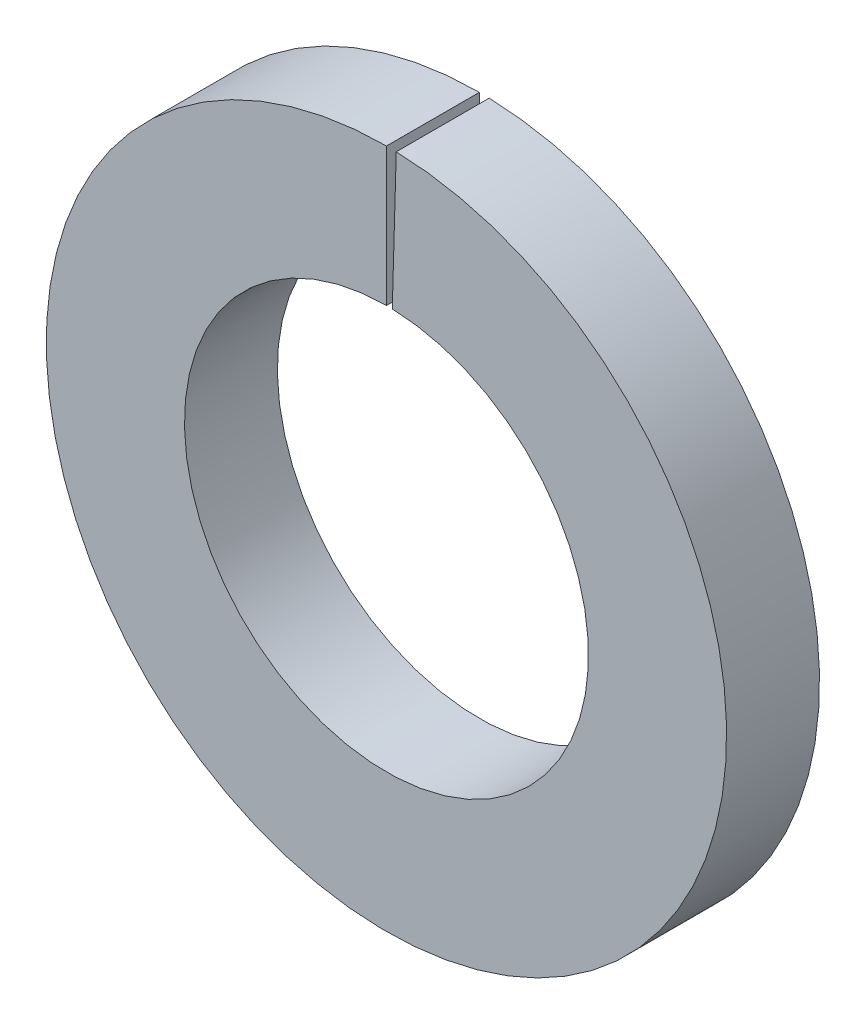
SolidWorks part; units mm, degrees
ref_plane "Plane1" through (0, 0, 0) normal (0, 0, 1) x (1, 0, 0)
ref_plane "Plane2" through (0, 0, 0) normal (0, 1, 0) x (1, 0, 0)
ref_plane "Plane3" through (0, 0, 0) normal (1, 0, 0) x (0, 0, -1)
sketch "Sketch1" plane through (0, 0, 0) normal (0, 0, 1) x (1, 0, 0)
  circle A0 centre (0, 0) radius 4.2418
  circle A1 centre (0, 0) radius 2.54
  dimension "O.D." = 8.4836
  dimension "I.D." = 5.08
extrude "Washer" add sketch "Sketch1" along normal blind 1.1938
sketch "Sketch2" plane through (0, 0, 0) normal (0, 0, -1) x (-1, 0, 0)
  line L0 (0, 2.54) -> (0, 4.2418)
  line L1 (-0.0635, 2.5392) -> (-0.106, 4.2405)
  line L2 (0, 0) -> (0, 4.2418) construction
  line L3 (0, 0) -> (-0.106, 4.2405) construction
  circle A0 centre (0, 0) radius 2.54 construction
  circle A1 centre (0, 0) radius 4.2418 construction
  arc A2 (0, 2.54) -> (-0.0635, 2.5392) centre (0, 0) ccw
  arc A3 (0, 4.2418) -> (-0.106, 4.2405) centre (0, 0) ccw
  dimension "D1" = 0.0635
extrude "Cut-Extrude1" cut sketch "Sketch2" against normal through all
